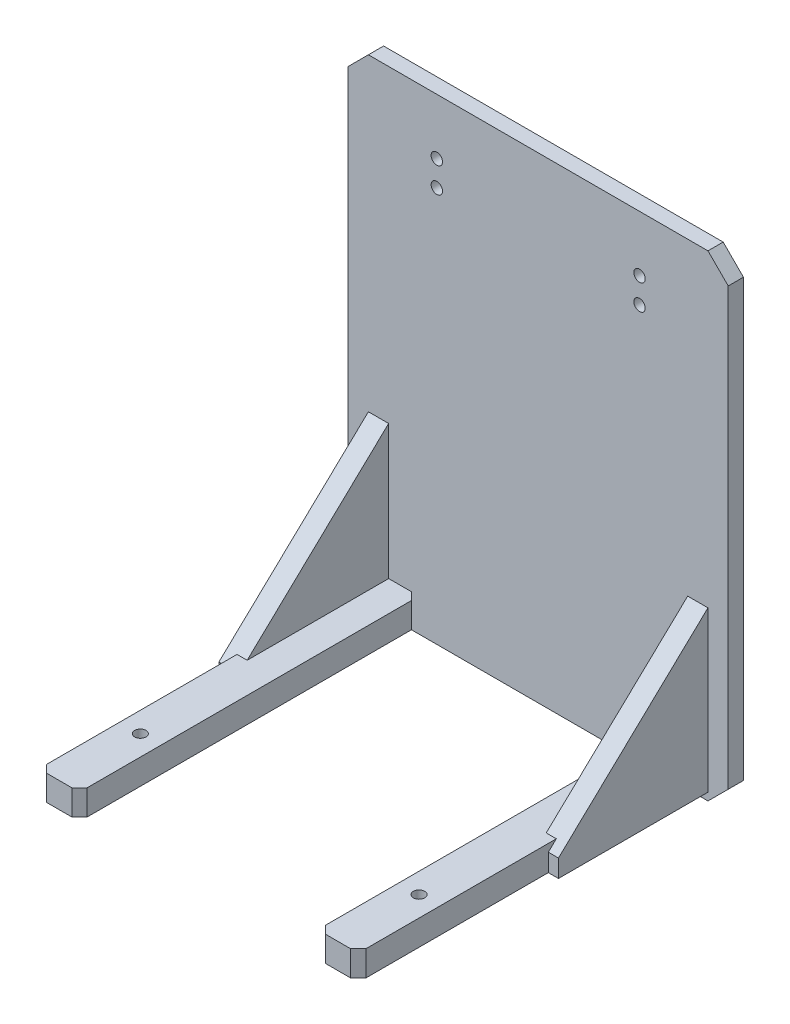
SolidWorks part; units mm, degrees
ref_plane "前视基准面" through (0, 0, 0) normal (0, 0, 1) x (1, 0, 0)
ref_plane "上视基准面" through (0, 0, 0) normal (0, 1, 0) x (1, 0, 0)
ref_plane "右视基准面" through (0, 0, 0) normal (1, 0, 0) x (0, 0, -1)
other "Configuration Table"
sketch "草图1" plane through (0, 0, 0) normal (0, 0, 1) x (1, 0, 0)
  line L0 (-67, -108) -> (67, -108)
  line L1 (67, -108) -> (75, -100)
  line L2 (75, -100) -> (75, 72)
  line L3 (75, 72) -> (67, 80)
  line L4 (67, 80) -> (-67, 80)
  line L5 (-67, 80) -> (-75, 72)
  line L6 (-75, 72) -> (-75, -100)
  line L7 (-75, -100) -> (-67, -108)
  circle A0 centre (-40, 48) radius 2.25
  circle A1 centre (-40, 58) radius 2.25
  circle A2 centre (40, 48) radius 2.25
  circle A3 centre (40, 58) radius 2.25
  dimension "D1" = 4.5
  dimension "D2" = 40
  dimension "D3" = 67
  dimension "D4" = 75
  dimension "D5" = 40
  dimension "D6" = 67
  dimension "D7" = 48
  dimension "D8" = 58
  dimension "D9" = 72
  dimension "D10" = 80
  dimension "D11" = 100
extrude "Base_150x188x6_four_M4_shoe_holes" add sketch "草图1" along normal blind 6
sketch "草图2" plane through (0, 0, 0) normal (0, 1, 0) x (1, 0, 0)
  line L0 (-60, -6) -> (-50, -6)
  line L1 (-50, -6) -> (-47, -9)
  line L2 (-47, -9) -> (-47, -137)
  line L3 (-47, -137) -> (-50, -140)
  line L4 (-50, -140) -> (-60, -140)
  line L5 (-60, -140) -> (-63, -137)
  line L6 (-63, -137) -> (-63, -9)
  line L7 (-63, -9) -> (-60, -6)
  line L8 (50, -6) -> (60, -6)
  line L9 (60, -6) -> (63, -9)
  line L10 (63, -9) -> (63, -137)
  line L11 (63, -137) -> (60, -140)
  line L12 (60, -140) -> (50, -140)
  line L13 (50, -140) -> (47, -137)
  line L14 (47, -137) -> (47, -9)
  line L15 (47, -9) -> (50, -6)
  circle A0 centre (-55, -108) radius 2.25
  circle A1 centre (55, -108) radius 2.25
  dimension "D1" = 4.5
  dimension "D2" = 47
  dimension "D3" = 50
  dimension "D4" = 55
  dimension "D5" = 60
  dimension "D6" = 47
  dimension "D7" = 6
  dimension "D8" = 9
  dimension "D9" = 55
  dimension "D10" = 108
  dimension "D11" = 137
extrude "Fixed_masts_M4_pitch110" add sketch "草图2" along normal blind 10 from offset 105
sketch "草图3" plane through (0, 0, 0) normal (1, 0, 0) x (0, 0, -1)
  line L0 (-6, -105) -> (-6, -42)
  line L1 (-6, -42) -> (-65, -98)
  line L2 (-65, -98) -> (-65, -105)
  line L3 (-65, -105) -> (-6, -105)
  dimension "D1" = 6
  dimension "D2" = 65
  dimension "D3" = 42
  dimension "D4" = 98
  dimension "D5" = 105
extrude "Left_gusset" add sketch "草图3" along normal blind 8 from offset 67
sketch "草图4" plane through (0, 0, 0) normal (1, 0, 0) x (0, 0, -1)
  line L0 (-6, -105) -> (-6, -42)
  line L1 (-6, -42) -> (-65, -98)
  line L2 (-65, -98) -> (-65, -105)
  line L3 (-65, -105) -> (-6, -105)
  dimension "D1" = 6
  dimension "D2" = 65
  dimension "D3" = 42
  dimension "D4" = 98
  dimension "D5" = 105
extrude "Right_gusset" add sketch "草图4" along normal blind 8 from offset 59
